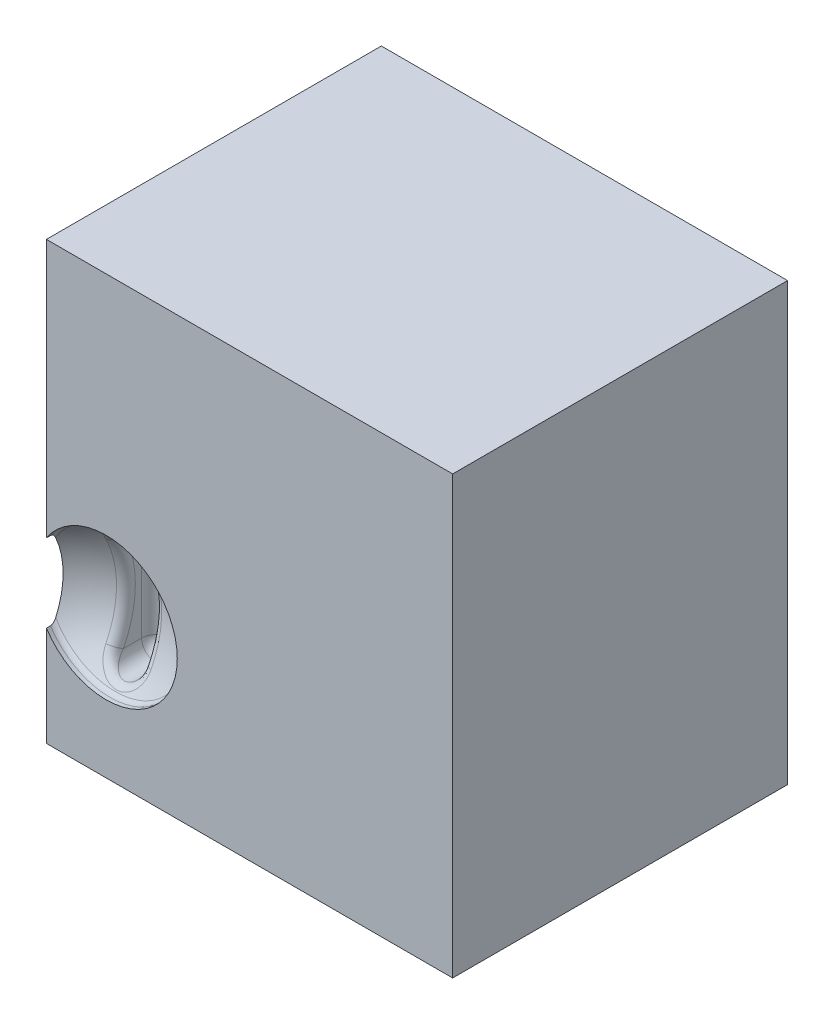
SolidWorks part; units mm, degrees
ref_plane "Ebene vorne" through (0, 0, 0) normal (0, 0, 1) x (1, 0, 0)
ref_plane "Ebene oben" through (0, 0, 0) normal (0, 1, 0) x (1, 0, 0)
ref_plane "Ebene rechts" through (0, 0, 0) normal (1, 0, 0) x (0, 0, -1)
sketch "Skizze1" plane through (0, 0, 0) normal (0, 0, 1) x (1, 0, 0)
  line L1 (0, 0) -> (114.0177, 0)
  line L2 (0, 0) -> (0, 122.5158)
  line L3 (0, 122.5158) -> (114.0177, 122.5158)
  line L4 (114.0177, 0) -> (114.0177, 122.5158)
extrude "Linear austragen1" add sketch "Skizze1" against normal blind 94
other "Formnest2"
other "Spritzteil-Schaltergriff<2>@Baugruppe12"
equation "\"LÄNGE\"=0"
equation "\"BREITE\"=0"
equation "\"HÖHE\"=0"
equation "\"DURCHMESSER\"=0"
equation "\"Stückzahl\"= 1"
